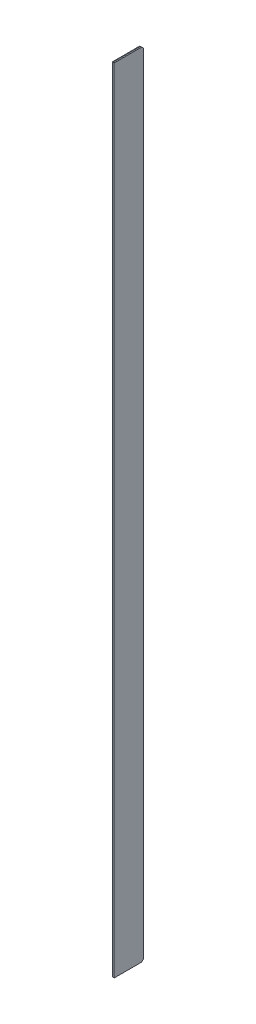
SolidWorks part; units mm, degrees
ref_plane "Front Plane" through (0, 0, 0) normal (1, 0, 0) x (0, 1, 0)
ref_plane "Top Plane" through (0, 0, 0) normal (0, 0, 1) x (0, 1, 0)
ref_plane "Right Plane" through (0, 0, 0) normal (0, 1, 0) x (-1, 0, 0)
sketch "Sketch1" plane through (0, 0, 0) normal (0, 1, 0) x (-1, 0, 0)
  line L1 (-19.05, 304.8) -> (19.05, 304.8)
  line L2 (-19.05, 304.8) -> (-19.05, -304.8)
  line L3 (-19.05, -304.8) -> (19.05, -304.8)
  line L4 (19.05, 304.8) -> (19.05, -304.8)
  line L5 (-19.05, 304.8) -> (19.05, -304.8) construction
  line L6 (-19.05, -304.8) -> (19.05, 304.8) construction
  point P0 (0, 0)
  dimension "D1" = 609.6
  dimension "D2" = 38.1
extrude "Boss-Extrude1" add sketch "Sketch1" along normal blind 16422.825
ref_plane "Mating plane" through (0, 0, -554.8) normal (0, 0, -1) x (0, 1, 0)
chamfer "Chamfer1" distance 13 angle 45 8 edges at (0, 0, 304.8) (19.05, 0, 0) (0, 0, -304.8) (-19.05, 0, 0) (0, 16422.825, -304.8) (19.05, 16422.825, 0) (0, 16422.825, 304.8) (-19.05, 16422.825, 0)
sketch "Sketch2" plane through (0, 0, 0) normal (1, 0, 0) x (0, 1, 0)
  line L6 (0, -304.8) -> (0, -249.8)
  line L7 (0, -249.8) -> (55, -304.8)
  line L8 (55, -304.8) -> (0, -304.8)
  line L9 (16409.825, -304.8) -> (13, -304.8) construction
  line L10 (0, -291.8) -> (0, 291.8) construction
  line L11 (16367.825, -304.8) -> (16422.825, -304.8)
  line L12 (16422.825, -304.8) -> (16422.825, -249.8)
  line L13 (16422.825, -249.8) -> (16367.825, -304.8)
  line L14 (16422.825, 291.8) -> (16422.825, -291.8) construction
  dimension "D1" = 55
  dimension "D2" = 55
  dimension "D3" = 55
  dimension "D4" = 55
extrude "Cut-Extrude1" cut sketch "Sketch2" against normal through all both and the other way through all
